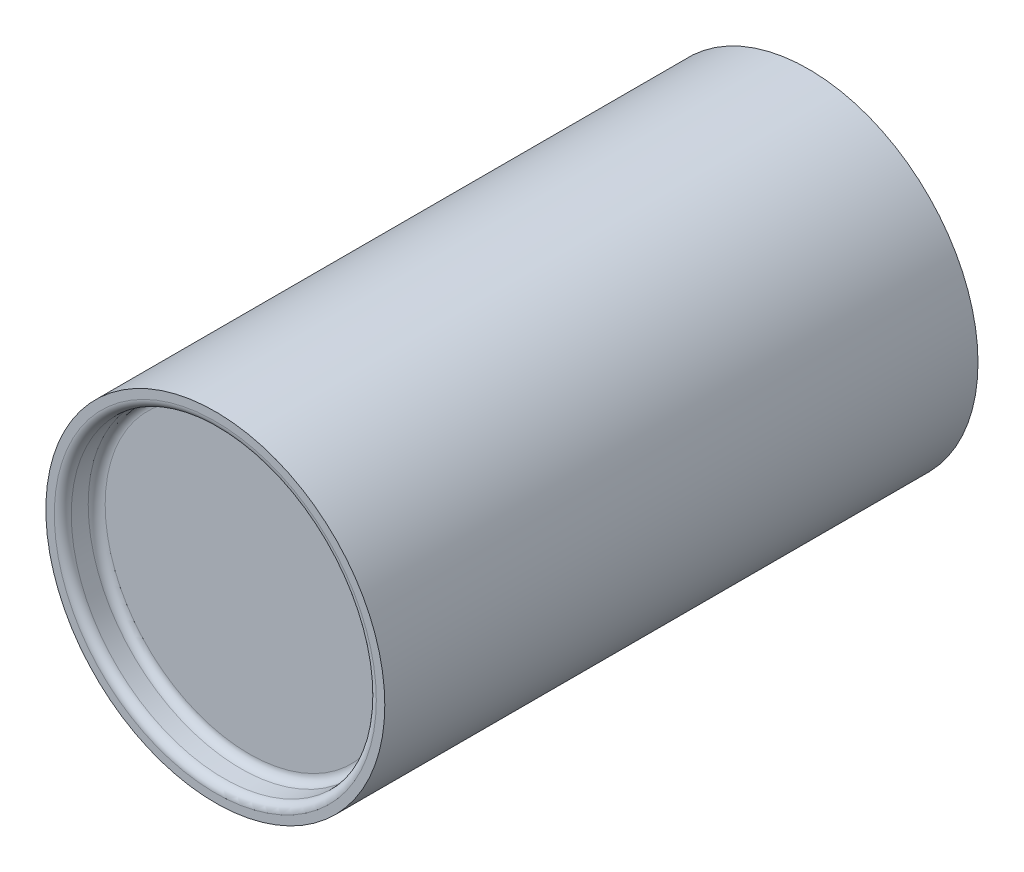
SolidWorks part; units mm, degrees
ref_plane "Plan de face" through (0, 0, 0) normal (0, 0, 1) x (1, 0, 0)
ref_plane "Plan de dessus" through (0, 0, 0) normal (0, 1, 0) x (1, 0, 0)
ref_plane "Plan de droite" through (0, 0, 0) normal (1, 0, 0) x (0, 0, -1)
sketch "Esquisse1" plane through (0, 0, 0) normal (0, 0, 1) x (1, 0, 0)
  circle A0 centre (0, 0) radius 10
  dimension "D1" = 20
extrude "Boss.-Extru.1" add sketch "Esquisse1" along normal blind 35
sketch "Esquisse2" plane through (0, 0, 0) normal (0, 0, -1) x (-1, 0, 0)
  circle A0 centre (0, 0) radius 9
  dimension "D1" = 18
extrude "Enlèv. mat.-Extru.1" cut sketch "Esquisse2" against normal blind 2
sketch "Esquisse3" plane through (0, 0, 35) normal (0, 0, 1) x (1, 0, 0)
  circle A0 centre (0, 0) radius 9
  dimension "D1" = 18
extrude "Enlèv. mat.-Extru.2" cut sketch "Esquisse3" against normal blind 2
fillet "Congé1" radius 0.5 4 edges at (9, 0, 35) (9, 0, 33) (-9, 0, 0) (-9, 0, 2)
